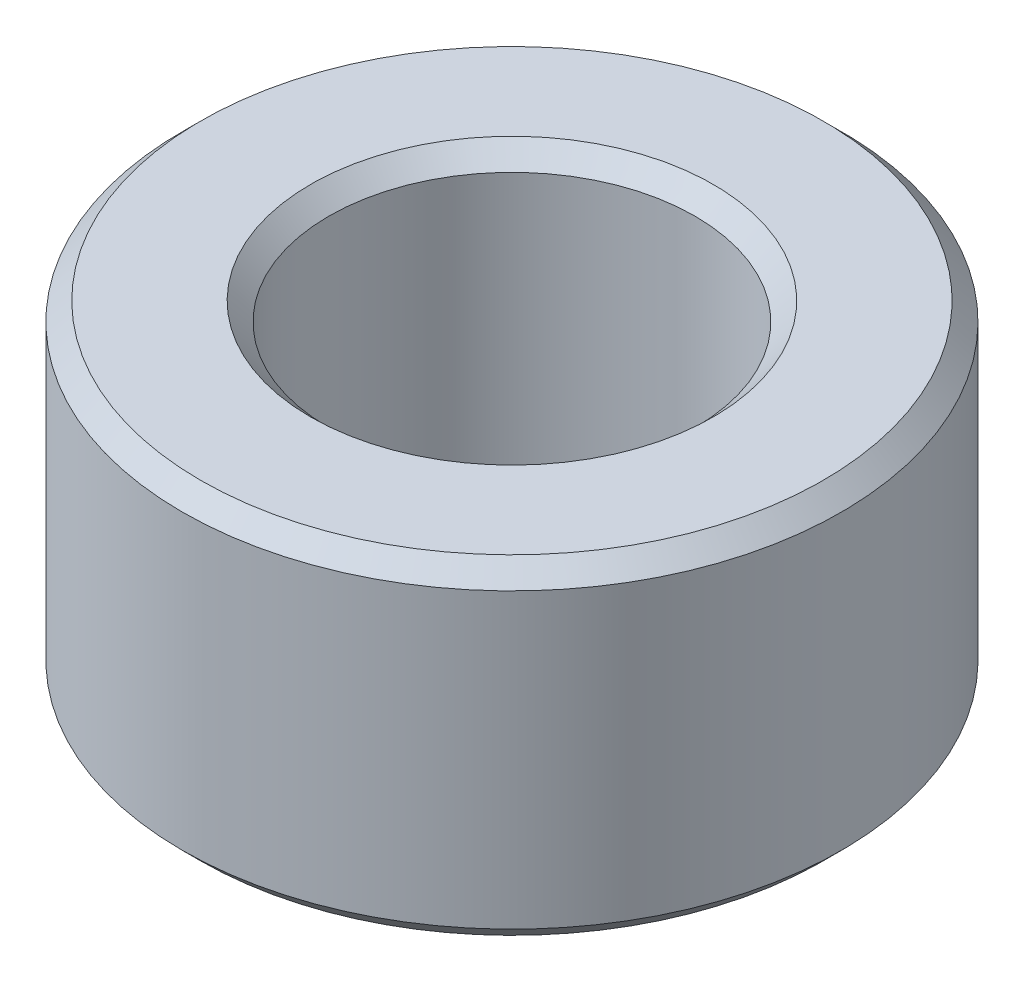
SolidWorks part; units mm, degrees
ref_plane "Plan1" through (0, 0, 0) normal (0, 0, 1) x (1, 0, 0)
ref_plane "Plan2" through (0, 0, 0) normal (0, 1, 0) x (1, 0, 0)
ref_plane "Plan3" through (0, 0, 0) normal (1, 0, 0) x (0, 0, -1)
sketch "Esquisse1" plane through (0, 0, 0) normal (0, 0, 1) x (1, 0, 0)
  line L0 (0, 40) -> (0, -30) construction
  line L1 (-5.5, 0) -> (-8.5, 0)
  line L2 (-8.5, 0) -> (-9, 0.5)
  line L3 (-9, 8.5) -> (-9, 0.5)
  line L4 (-9, 8.5) -> (-8.5, 9)
  line L5 (-8.5, 9) -> (-5.5, 9)
  line L6 (-5.5, 9) -> (-5, 8.5)
  line L7 (-5, 8.5) -> (-5, 0.5)
  line L8 (-5, 0.5) -> (-5.5, 0)
  dimension "D1" = 10
  dimension "D2" = 18
  dimension "D3" = 0.5
  dimension "D4" = 11
  dimension "D5" = 11
  dimension "D6" = 9
  dimension "D7" = 135
revolve "Base-Révolution" add sketch "Esquisse1" angle 360 about L0
